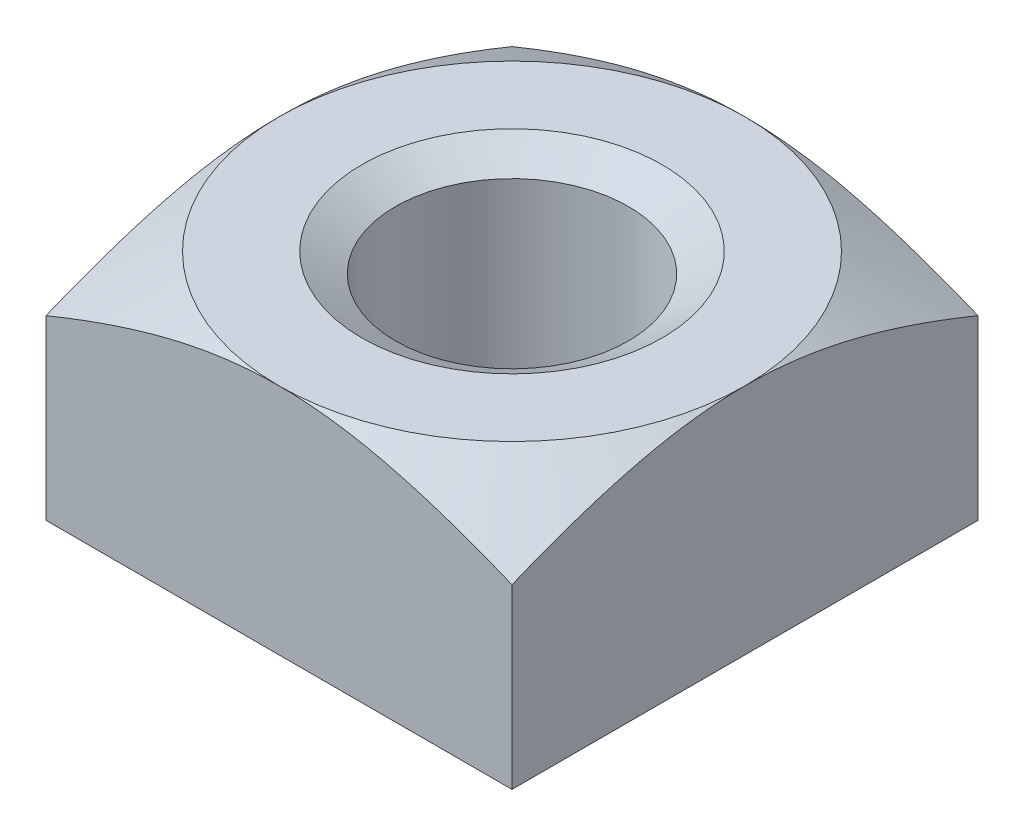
SolidWorks part; units mm, degrees
ref_plane "Front Plane" through (0, 0, 0) normal (0, 0, 1) x (1, 0, 0)
ref_plane "Top Plane" through (0, 0, 0) normal (0, 1, 0) x (1, 0, 0)
ref_plane "Right Plane" through (0, 0, 0) normal (1, 0, 0) x (0, 0, -1)
sketch "BaseNutSke" plane through (0, 0, 0) normal (0, 1, 0) x (1, 0, 0)
  line L0 (-54.4776, 0) -> (74.7044, 0) construction
  line L1 (0, 52.5898) -> (0, -71.4681) construction
  line L3 (-5, 5) -> (5, 5)
  line L4 (-5, 5) -> (-5, -5)
  line L5 (-5, -5) -> (5, -5)
  line L6 (5, 5) -> (5, -5)
  dimension "Width" = 10
extrude "BaseNut" add sketch "BaseNutSke" along normal blind 5
sketch "CutNutSke" plane through (0, 0, 0) normal (0, 0, 1) x (1, 0, 0)
  line L0 (5, 5) -> (13.6603, 5)
  line L1 (13.6603, 5) -> (13.6603, 0)
  line L2 (13.6603, 0) -> (5, 5)
  line L3 (0, 0) -> (0, 5.607) construction
  line L4 (-5, 5) -> (5, 5) construction
  dimension "D1" = 30
revolve "CutNut" cut sketch "CutNutSke" angle 360 about L3
sketch "HoleSke" plane through (0, 5, 0) normal (0, 1, 0) x (1, 0, 0)
  circle A0 centre (0, 0) radius 2.5
  dimension "Tap_drill" = 5
extrude "TappedHole" cut sketch "HoleSke" against normal through all
chamfer "Chamfer1" distance 0.4167 angle 60 2 edges at (0, 0, 2.5) (0, 5, 2.5)
sketch "ThdSchSke" plane through (0, 0, 0) normal (0, 0, 1) x (1, 0, 0)
  line L0 (3, 4.2947) -> (2.5, 4.5833)
  line L1 (2.5, 4.5833) -> (1.9226, 4.5833)
  line L2 (1.9226, 4.5833) -> (1.9226, 4.006)
  line L3 (1.9226, 4.006) -> (2.5, 4.006)
  line L4 (2.5, 4.006) -> (3, 4.2947)
  line L6 (2.5, 4.5833) -> (-2.5, 4.5833) construction
  line L7 (0, 0) -> (0, 3.2439) construction
  dimension "D1" = 6
  dimension "D2" = 5
revolve "ThreadSchematic" [suppressed] cut sketch "ThdSchSke" angle 360 about L7
pattern_linear "ThdSchPat" [suppressed] count 5 along (0, 1, 0)
equation "\"D1@Chamfer1\" = \"Tap_drill@HoleSke\"/12"
equation "\"D1@ThdSchSke\" = \"Thread_major@ThreadCosmetic\""
equation "\"D2@ThdSchSke\" = \"Tap_drill@HoleSke\""
equation "\"D1@ThdSchPat\" =  int(( \"Height@BaseNut\" -\"D1@Chamfer1\"*2)/ \"ADVANCE@ThdSchPat\" ) +1"
